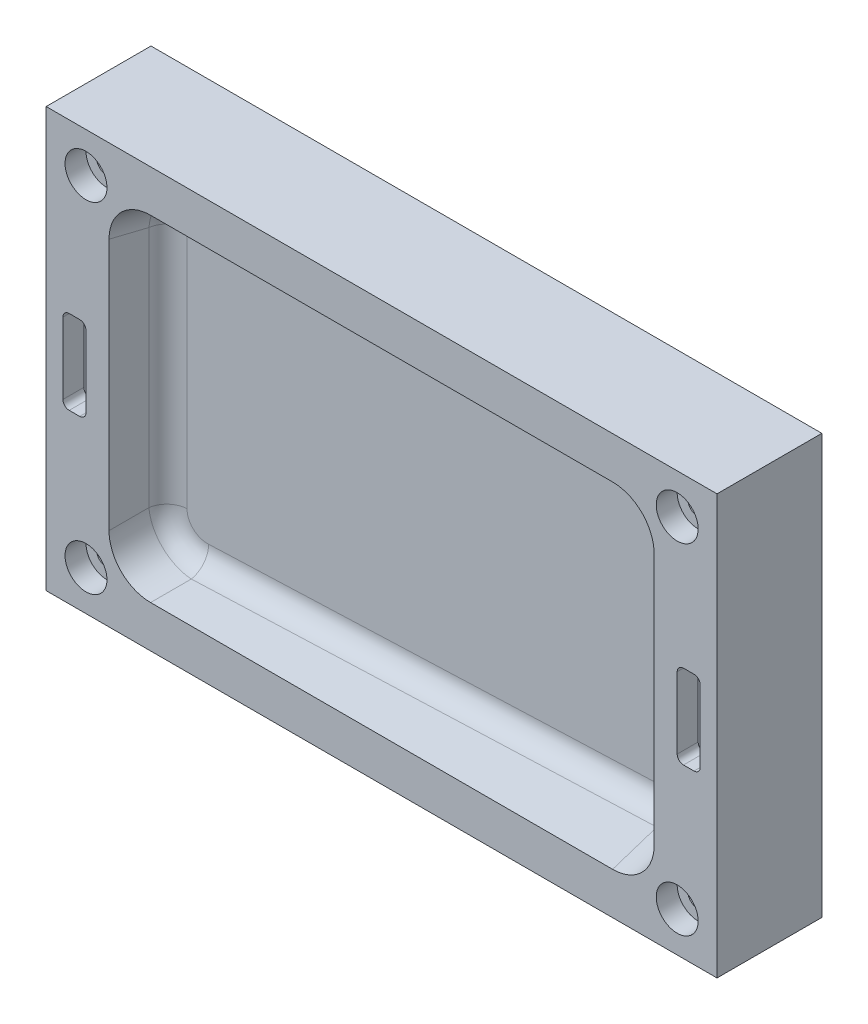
SolidWorks part; units mm, degrees
ref_plane "Plane1" through (0, 0, 0) normal (0, 0, 1) x (1, 0, 0)
ref_plane "Plane2" through (0, 0, 0) normal (0, 1, 0) x (1, 0, 0)
ref_plane "Plane3" through (0, 0, 0) normal (1, 0, 0) x (0, 0, -1)
sketch "Sketch1" plane through (0, 0, 0) normal (0, 0, 1) x (1, 0, 0)
  line L0 (0, 0) -> (203.2, 0)
  line L1 (0, 0) -> (0, 127)
  line L2 (203.2, 127) -> (0, 127)
  line L3 (203.2, 127) -> (203.2, 0)
  dimension "D1" = 127
  dimension "D2" = 203.2
extrude "Base-Extrude" add sketch "Sketch1" against normal blind 31.75
sketch "Sketch2" plane through (0, 0, 0) normal (0, 0, 1) x (1, 0, 0)
  line L0 (19.05, 114.3) -> (184.15, 114.3)
  line L1 (19.05, 114.3) -> (19.05, 12.7)
  line L2 (184.15, 12.7) -> (19.05, 12.7)
  line L3 (184.15, 12.7) -> (184.15, 114.3)
  line L4 (203.2, 127) -> (0, 127) construction
  line L5 (0, 0) -> (0, 127) construction
  line L6 (0, 0) -> (203.2, 0) construction
  line L7 (203.2, 127) -> (203.2, 0) construction
  dimension "D1" = 12.7
  dimension "D2" = 19.05
  dimension "D3" = 12.7
  dimension "D4" = 19.05
extrude "Cut-Extrude1" cut sketch "Sketch2" against normal blind 15.875 draft 8
draft "Draft1" type of draft neutral plane draft angle 10 faces to draft 1 parameters "D1"=10
ref_plane "Plane4" through (0, 0, -6.35) normal (0, 0, 1) x (1, 0, 0)
fillet "Fillet1" radius 12.7 4 edges at (20.1655, 13.8155, -7.9375) (20.1655, 113.1845, -7.9375) (182.6422, 112.7922, -10.7286) (182.6422, 14.2078, -10.7286)
fillet "Fillet2" radius 6.35 8 edges at (21.2811, 63.5, -15.875) (101.2695, 111.6763, -18.6683) (101.2695, 15.3237, -18.6683) (181.1344, 63.5, -21.4572) (177.4834, 107.6334, -21.3297) (177.4834, 19.3666, -21.3297) (24.9681, 18.6181, -16.0038) (24.9681, 108.3819, -16.0038)
hole_wizard "Hole1" positions "Sketch5" profile "Sketch6" legacy
sketch "Sketch5" plane through (0, 0, 0) normal (0, 0, 1) x (1, 0, 0)
  line L0 (0, 0) -> (203.2, 0) construction
  line L1 (0, 0) -> (0, 127) construction
  point P0 (12.065, 12.0625)
  dimension "D1" = 12.0625
  dimension "D2" = 12.065
sketch "Sketch6" plane through (12.065, 12.0625, 0) normal (1, 0, 0) x (0, -1, 0)
  line L0 (0, 0) -> (0, 31.75)
  line L1 (0, 31.75) -> (3.175, 31.75)
  line L2 (3.175, 31.75) -> (3.175, 6.35)
  line L3 (3.175, 6.35) -> (6.35, 6.35)
  line L4 (6.35, 6.35) -> (6.35, 0)
  line L5 (6.35, 0) -> (0, 0)
  line L6 (0, 110) -> (0, -10) construction
  dimension "Diameter" = 6.35
  dimension "Depth" = 31.75
  dimension "C-Bore Diameter" = 12.7
  dimension "C-Bore Depth" = 6.35
pattern_linear "LPattern1" count 2 spacing 179.07 along (1, 0, 0) count 2 spacing 102.87 along (0, 1, 0) of "Hole1"
sketch "Sketch7" plane through (0, 0, 0) normal (0, 0, 1) x (1, 0, 0)
  line L0 (193.04, 76.2) -> (196.215, 76.2)
  line L1 (191.135, 74.295) -> (191.135, 52.705)
  line L2 (196.215, 50.8) -> (193.04, 50.8)
  line L3 (198.12, 52.705) -> (198.12, 74.295)
  line L4 (6.985, 76.2) -> (10.16, 76.2)
  line L5 (5.08, 74.295) -> (5.08, 52.705)
  line L6 (10.16, 50.8) -> (6.985, 50.8)
  line L7 (12.065, 52.705) -> (12.065, 74.295)
  line L9 (203.2, 127) -> (0, 127) construction
  line L10 (203.2, 127) -> (203.2, 0) construction
  line L11 (0, 0) -> (0, 127) construction
  arc A0 (193.04, 50.8) -> (191.135, 52.705) centre (193.04, 52.705) cw
  arc A1 (196.215, 76.2) -> (198.12, 74.295) centre (196.215, 74.295) cw
  arc A2 (196.215, 50.8) -> (198.12, 52.705) centre (196.215, 52.705) ccw
  arc A3 (193.04, 76.2) -> (191.135, 74.295) centre (193.04, 74.295) ccw
  arc A4 (6.985, 76.2) -> (5.08, 74.295) centre (6.985, 74.295) ccw
  arc A5 (12.065, 52.705) -> (10.16, 50.8) centre (10.16, 52.705) cw
  arc A6 (10.16, 76.2) -> (12.065, 74.295) centre (10.16, 74.295) cw
  arc A7 (5.08, 52.705) -> (6.985, 50.8) centre (6.985, 52.705) ccw
  dimension "D9" = 1.905
  dimension "D1" = 1.905
  dimension "D4" = 1.905
  dimension "D10" = 1.905
  dimension "D2" = 1.905
  dimension "D3" = 1.905
  dimension "D11" = 1.905
  dimension "D12" = 1.905
  dimension "D5" = 50.8
  dimension "D6" = 5.08
  dimension "D7" = 5.08
  dimension "D8" = 50.8
extrude "Cut-Extrude2" cut sketch "Sketch7" against normal blind 6.35
